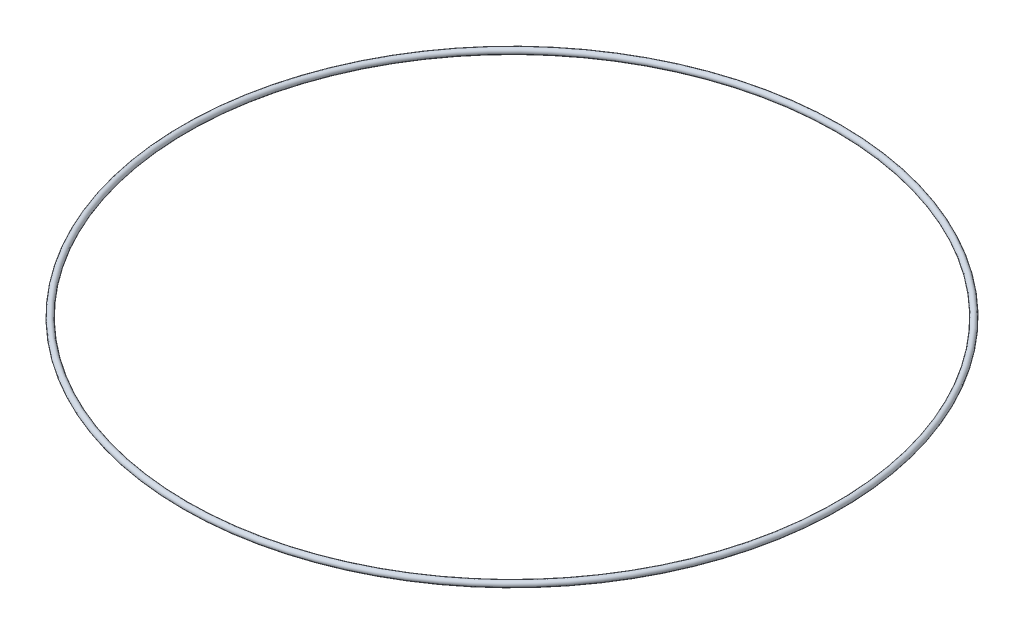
SolidWorks part; units mm, degrees
ref_plane "Front" through (0, 0, 0) normal (0, 0, 1) x (1, 0, 0)
ref_plane "Top" through (0, 0, 0) normal (0, 1, 0) x (1, 0, 0)
ref_plane "Right" through (0, 0, 0) normal (1, 0, 0) x (0, 0, -1)
sketch "Sketch1" plane through (0, 0, 0) normal (0, 0, 1) x (1, 0, 0)
  line L0 (0, 96.52) -> (0, -73.66) construction
  line L1 (0, 0) -> (-224.3753, 0) construction
  circle A0 centre (-294.005, 0) radius 2.667
  dimension "D1" = 5.334
  dimension "D2" = 588.01
revolve "Revolve1" add sketch "Sketch1" angle 360 about L0
